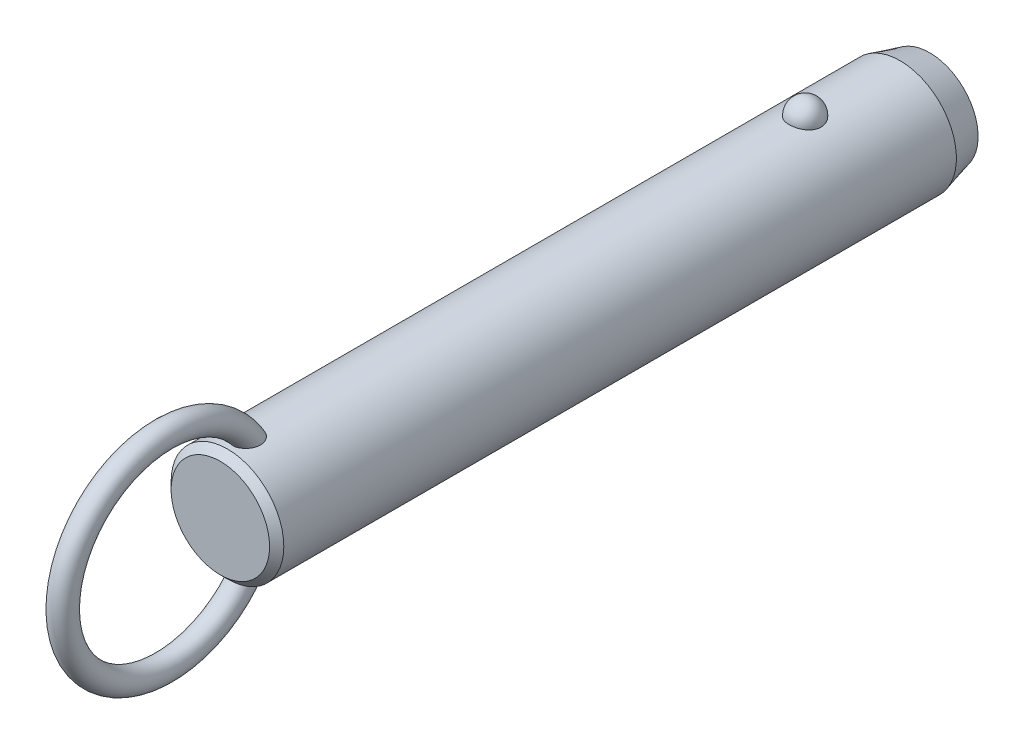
SolidWorks part; units mm, degrees
ref_plane "Front Plane" through (0, 0, 0) normal (0, 0, 1) x (1, 0, 0)
ref_plane "Top Plane" through (0, 0, 0) normal (0, 1, 0) x (1, 0, 0)
ref_plane "Right Plane" through (0, 0, 0) normal (1, 0, 0) x (0, 0, -1)
sketch "Sketch2" plane through (0, 0, 0) normal (0, 0, 1) x (1, 0, 0)
  circle A0 centre (0, 0) radius 9.5
  point P3 (0, 9.5)
  dimension "D1" = 19
extrude "Boss-Extrude1" add sketch "Sketch2" along normal blind 86.4
sketch "Sketch3" plane through (0, 0, 0) normal (0, 0, -1) x (-1, 0, 0)
  circle A0 centre (0, 0) radius 9.5
  dimension "D1" = 19
extrude "Boss-Extrude2" add sketch "Sketch3" along normal blind 23.7
chamfer "Chamfer1" distance 5 angle 15 1 edges at (-9.5, 0, -23.7)
sketch "Sketch12" plane through (0, 0, 0) normal (1, 0, 0) x (0, 0, -1)
  line L0 (-86.4, 9.5) -> (-86.4, -9.5) construction
  point P0 (-86.4, 0)
sketch "Sketch13" plane through (0, 0, 0) normal (1, 0, 0) x (0, 0, -1)
  circle A0 centre (-105.45, 0) radius 19.05
  point P2 (-86.4, 0)
  dimension "D1" = 38.1
sketch "Sketch14" plane through (0, 0, 0) normal (0, 1, 0) x (1, 0, 0)
  circle A0 centre (0, -88.4) radius 2
  point P2 (0, -86.4)
  dimension "D1" = 4
sweep "Sweep1" add profiles "Sketch14" path "Sketch13"
sketch "Sketch15" plane through (0, 0, 86.4) normal (0, 0, 1) x (1, 0, 0)
  circle A0 centre (0, 0) radius 9.5
  dimension "D1" = 19
extrude "Boss-Extrude3" add sketch "Sketch15" along normal blind 9.52
chamfer "Chamfer2" distance 1.2 angle 45 1 edges at (9.5, 0, 95.92)
sketch "Sketch18" plane through (0, 0, 0) normal (1, 0, 0) x (0, 0, -1)
  line L0 (18.7, 9.5) -> (-88.9378, 9.5) construction
  line L1 (2.7, 12.2) -> (2.7, 6.8)
  line L2 (-88.9378, -9.5) -> (18.7, -9.5) construction
  arc A0 (2.7, 12.2) -> (2.7, 6.8) centre (2.7, 9.5) ccw
  point P4 (0, 9.5)
  dimension "D1" = 21.7
revolve "Revolve1" add sketch "Sketch18" angle 360 about L1
